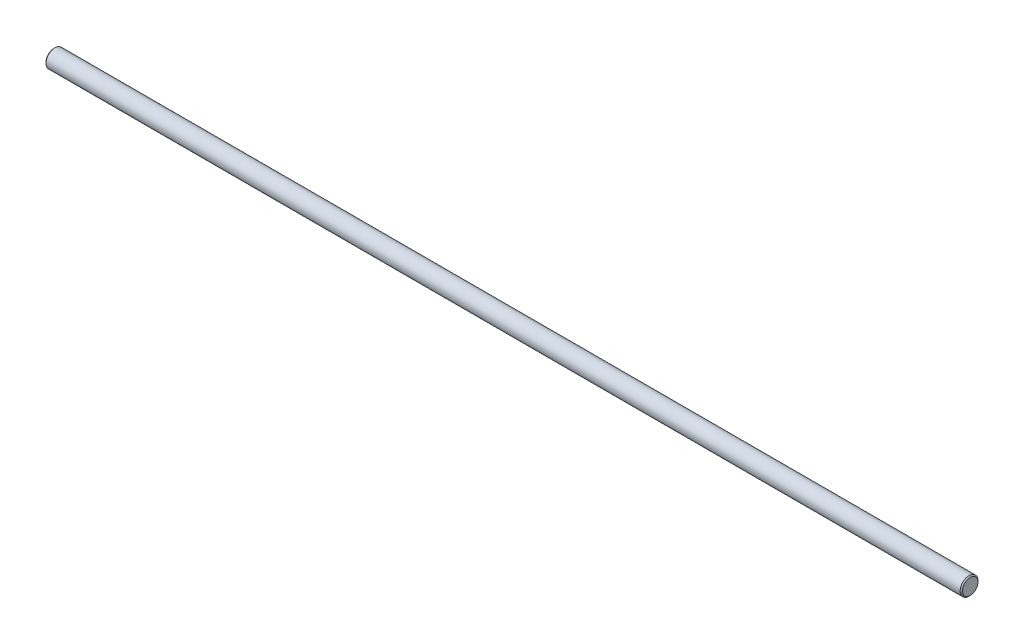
SolidWorks part; units mm, degrees
ref_plane "Front Plane" through (0, 0, 0) normal (0, 0, 1) x (1, 0, 0)
ref_plane "Top Plane" through (0, 0, 0) normal (0, 1, 0) x (1, 0, 0)
ref_plane "Right Plane" through (0, 0, 0) normal (1, 0, 0) x (0, 0, -1)
ref_plane "Plane1" through (0, 0, 0) normal (0, 0, 1) x (1, 0, 0)
sketch "Sketch1" plane through (0, 0, 0) normal (0, 0, 1) x (1, 0, 0)
  line L0 (0, 0) -> (0, 3.5)
  line L1 (0, 3.5) -> (0.5, 4)
  line L2 (0.5, 4) -> (409.5, 4)
  line L3 (409.5, 4) -> (410, 3.5)
  line L4 (410, 3.5) -> (410, 0)
  line L5 (410, 0) -> (0, 0)
  line L6 (410, 0) -> (0, 0) construction
  line L7 (205, 4) -> (205, 0) construction
  dimension "D1" = 410
  dimension "D2" = 4
  dimension "D3" = 0.5
  dimension "D4" = 45
revolve "Revolve1" add sketch "Sketch1" angle 360 about L6
ref_plane "Plane2" through (205, 0, 0) normal (-1, 0, 0) x (0, 0, 1)
